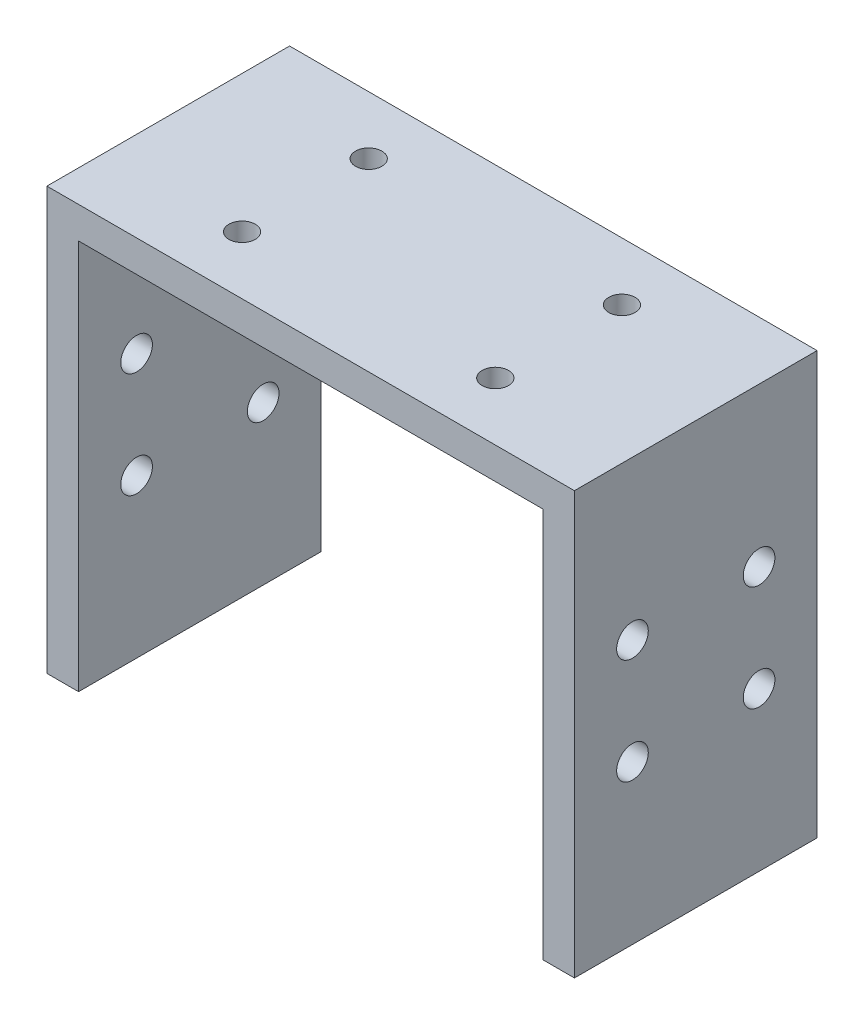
SolidWorks part; units mm, degrees
ref_plane "Front Plane" through (0, 0, 0) normal (0, 0, 1) x (1, 0, 0)
ref_plane "Top Plane" through (0, 0, 0) normal (0, 1, 0) x (1, 0, 0)
ref_plane "Right Plane" through (0, 0, 0) normal (1, 0, 0) x (0, 0, -1)
sketch "Sketch1" plane through (0, 0, 0) normal (0, 1, 0) x (1, 0, 0)
  line L1 (-25, -11.5) -> (25, -11.5)
  line L2 (-25, -11.5) -> (-25, 11.5)
  line L3 (-25, 11.5) -> (25, 11.5)
  line L4 (25, -11.5) -> (25, 11.5)
  line L5 (-25, -11.5) -> (25, 11.5) construction
  line L6 (-25, 11.5) -> (25, -11.5) construction
  point P0 (0, 0)
  dimension "D1" = 50
  dimension "D2" = 23
extrude "Boss-Extrude1" add sketch "Sketch1" against normal blind 40
shell "Shell1" thickness 3
sketch "Sketch2" plane through (0, 0, 0) normal (0, 1, 0) x (1, 0, 0)
  line L0 (12, 11.5) -> (12, -11.5) construction
  line L1 (25, 11.5) -> (-25, 11.5) construction
  line L2 (-25, -11.5) -> (25, -11.5) construction
  line L3 (25, -11.5) -> (25, 11.5) construction
  line L4 (25, 0) -> (-25, 0) construction
  line L5 (-25, 11.5) -> (-25, -11.5) construction
  line L6 (-12, 11.5) -> (-12, -11.5) construction
  circle A0 centre (12, 6) radius 1.25
  circle A1 centre (12, -6) radius 1.25
  circle A2 centre (-12, 6) radius 1.25
  circle A3 centre (-12, -6) radius 1.25
  dimension "D7" = 2.5
  dimension "D8" = 2.5
  dimension "D9" = 2.5
  dimension "D10" = 2.5
  dimension "D1" = 13
  dimension "D2" = 6
  dimension "D3" = 6
  dimension "D4" = 24
  dimension "D5" = 6
  dimension "D6" = 6
extrude "Cut-Extrude1" cut sketch "Sketch2" against normal up to next
sketch "Sketch3" plane through (25, 0, 0) normal (1, 0, 0) x (0, 0, -1)
  line L0 (-11.5, -15) -> (11.5, -15) construction
  line L1 (-11.5, -40) -> (-11.5, 0) construction
  line L2 (11.5, -40) -> (11.5, 0) construction
  line L3 (-11.5, -25) -> (11.5, -25) construction
  line L4 (0, 0) -> (0, -40) construction
  line L5 (-11.5, -40) -> (11.5, -40) construction
  circle A0 centre (-6, -15) radius 1.5
  circle A1 centre (6, -15) radius 1.5
  circle A2 centre (-6, -25) radius 1.5
  circle A3 centre (6, -25) radius 1.5
  point P22 (0, -15)
  dimension "D7" = 3
  dimension "D8" = 3
  dimension "D9" = 3
  dimension "D10" = 3
  dimension "D1" = 15
  dimension "D2" = 10
  dimension "D3" = 6
  dimension "D4" = 6
  dimension "D5" = 6
  dimension "D6" = 6
extrude "Cut-Extrude2" cut sketch "Sketch3" against normal through all
